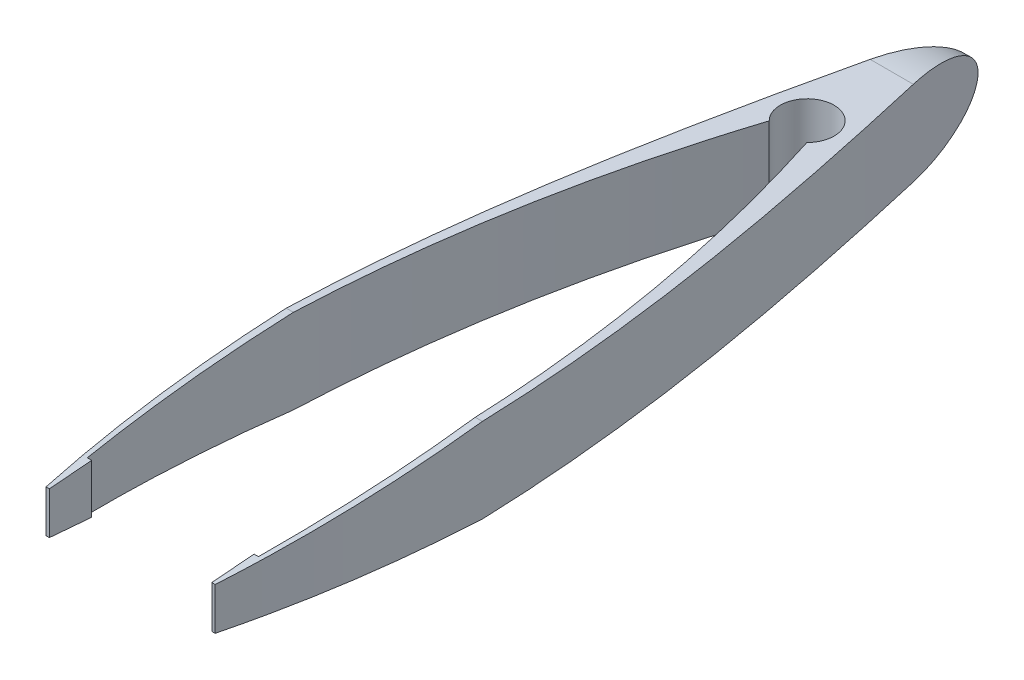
SolidWorks part; units mm, degrees
other "Camera1"
ref_plane "Front Plane" through (0, 0, 0) normal (0, 0, 1) x (1, 0, 0)
ref_plane "Top Plane" through (0, 0, 0) normal (0, 1, 0) x (1, 0, 0)
ref_plane "Right Plane" through (0, 0, 0) normal (1, 0, 0) x (0, 0, -1)
sketch "Sketch1" plane through (0, 0, 0) normal (0, 1, 0) x (1, 0, 0)
  line L0 (10, 0) -> (-10, 0) construction
  line L1 (0, 0) -> (0, 100) construction
  line L2 (0, 100) -> (-10, 0) construction
  line L3 (10, 0) -> (0, 100) construction
  line L4 (10, 0) -> (9.6, 0)
  line L5 (0.2, 100) -> (-0.2, 100)
  line L6 (11.6963, 25) -> (10.8963, 25) construction
  line L7 (8.7826, 50) -> (9.9826, 50) construction
  line L8 (3.175, 80) -> (4.775, 80) construction
  line L9 (-10, 0) -> (-9.6, 0)
  arc A0 (2.2264, 77.7364) -> (-2.2264, 77.7364) centre (0, 80) ccw
  spline S0 degree 3 poles (0.2, 100) (8.0246, 67.3415) (15.036, 33.934) (10, 0) knots 0 0 0 0 1 1 1 1
  spline S1 degree 2 poles (9.6, 0) (14.3013, 39.9157) (2.2264, 77.7364) knots 0 0 0 1 1 1
  spline S2 degree 2 poles (-9.6, 0) (-14.3013, 39.9157) (-2.2264, 77.7364) knots 0 0 0 1 1 1
  spline S3 degree 3 poles (-0.2, 100) (-8.0246, 67.3415) (-15.036, 33.934) (-10, 0) knots 0 0 0 0 1 1 1 1
  point P4 (0, 0)
  point P12 (0, 100)
  point P16 (11.6963, 25)
  point P18 (10.8963, 25)
  dimension "D3" = 0.4
  dimension "D5" = 6.35
  dimension "D1" = 20
  dimension "D2" = 100
  dimension "D4" = 0.4
  dimension "D6" = 80
  dimension "D7" = 1.2
  dimension "D8" = 0.8
  dimension "D9" = 50
  dimension "D10" = 25
  dimension "D11" = 1.6
extrude "Boss-Extrude1" add sketch "Sketch1" along normal mid plane 10
sketch "Sketch3" plane through (0, 0, 0) normal (1, 0, 0) x (0, 0, -1)
  line L0 (0, 0) -> (100, 0) construction
  line L1 (100, 5) -> (100, -5) construction
  line L2 (90, 0) -> (100, 0) construction
  line L3 (0, -2.5) -> (0, 2.5) construction
  line L4 (0, 5) -> (0, -5) construction
  line L5 (0, 2.5) -> (30, 5)
  line L6 (100, 5) -> (0, 5) construction
  line L7 (30, 5) -> (0, 5)
  line L9 (0, 5) -> (0, 2.5)
  line L10 (0, -5) -> (0, -2.5)
  line L11 (30, -5) -> (0, -5)
  line L12 (0, -2.5) -> (30, -5)
  line L13 (100, -5) -> (100, 5)
  line L14 (100, 5) -> (90, 5)
  line L17 (100, -5) -> (90, -5)
  ellipse E0 centre (90, 0) end of major axis (80, 0) minor radius 5 (90, -5) -> (90, 5) ccw
  point P16 (0, 0)
  dimension "D1" = 10
  dimension "D2" = 5
  dimension "D3" = 5
  dimension "D4" = 30
sketch "Sketch4" plane through (0, 0, 0) normal (0, 1, 0) x (1, 0, 0)
  line L3 (2.5809, 76.6138) -> (3.2539, 76.6138)
  line L4 (3.2539, 76.6138) -> (2.6998, 76.2319)
  line L5 (2.5809, 76.6138) -> (2.6998, 76.2319) construction
  parabola Q2 construction
  parabola Q3
  dimension "D1" = 0.4
sketch "Sketch6" plane through (0, 0, 0) normal (0, 1, 0) x (1, 0, 0)
  line L0 (-9.6, 0) -> (-9.6, 5)
  line L1 (-9.6, 5) -> (-10.1239, 5)
  line L2 (9.6, 0) -> (9.6, 5)
  line L3 (9.6, 5) -> (10.1239, 5)
  parabola Q0 construction
  parabola Q1 construction
  parabola Q2 construction
  parabola Q3 construction
  parabola Q4
  parabola Q5
  dimension "D1" = 5
extrude "Boss-Extrude3" add sketch "Sketch6" along normal up to surface and the other way up to surface
extrude "Cut-Extrude2" cut sketch "Sketch3" against normal through all both and the other way through all contours L12 L10 L11 | L7 L9 L5
sketch "Sketch7" plane through (0, 0, 0) normal (1, 0, 0) x (0, 0, -1)
  line L0 (100, -5) -> (100, 5) construction
  line L1 (100, 5) -> (90, 5) construction
  line L3 (100, 5) -> (90, 5)
  line L5 (100, 0) -> (100, 5)
  ellipse E0 centre (90, 0) end of major axis (80, 0) minor radius 5 (90, -5) -> (90, 5) ccw construction
  ellipse E1 centre (90, 0) end of major axis (80, 0) minor radius 5 (100, 0) -> (90, 5) ccw
extrude "Cut-Extrude3" cut sketch "Sketch7" against normal through all both and the other way through all
mirror "Mirror3" about plane through (0, 0, 0) normal (0, 1, 0) of "Cut-Extrude3"
